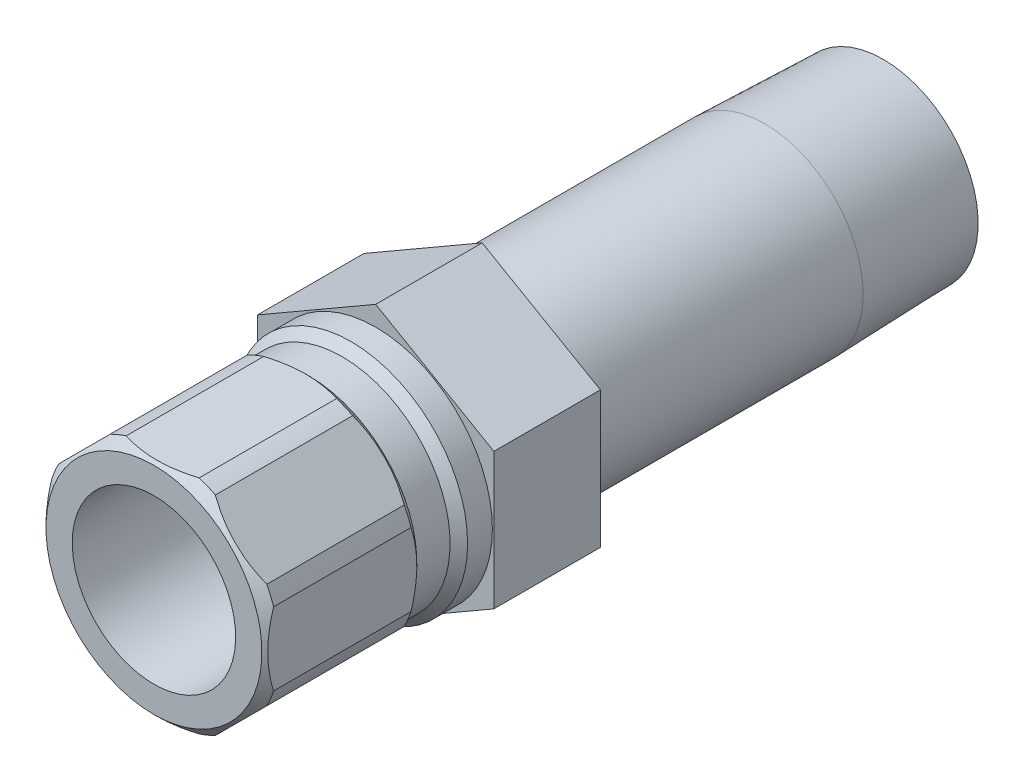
SolidWorks part; units mm, degrees
ref_plane "Front Plane" through (0, 0, 0) normal (0, 0, 1) x (1, 0, 0)
ref_plane "Top Plane" through (0, 0, 0) normal (0, 1, 0) x (1, 0, 0)
ref_plane "Right Plane" through (0, 0, 0) normal (1, 0, 0) x (0, 0, -1)
sketch "Sketch1" plane through (0, 0, 0) normal (1, 0, 0) x (0, 0, -1)
  line L0 (0, 0) -> (-22.479, 0) construction
  line L1 (-19.304, 7.112) -> (-19.304, 9.398)
  line L2 (-5.8166, 9.398) -> (-5.8166, 0) construction
  line L3 (-18.542, 10.16) -> (-6.5786, 10.16)
  line L4 (0, 8.5725) -> (0, 0) construction
  line L5 (-5.8166, 9.398) -> (-2.921, 9.398)
  line L6 (-2.159, 10.16) -> (0, 10.16)
  line L7 (0, 10.16) -> (0, 8.5725)
  line L8 (-5.8166, 9.398) -> (-6.5786, 10.16)
  line L9 (-2.921, 9.398) -> (-2.159, 10.16)
  line L10 (-19.304, 9.398) -> (-18.542, 10.16)
  line L11 (-19.304, 7.112) -> (-1.524, 7.112)
  line L12 (0, 8.5725) -> (33.8582, 8.5725)
  line L13 (33.8582, 8.5725) -> (44.196, 8.2494)
  line L14 (44.196, 8.2494) -> (44.196, 6.2611)
  line L15 (0, 10.16) -> (9.271, 10.16) construction
  line L16 (9.271, 10.16) -> (9.271, 7.112) construction
  line L17 (9.271, 0) -> (0, 0) construction
  line L18 (-1.524, 7.112) -> (-0.6731, 6.2611)
  line L19 (-0.6731, 6.2611) -> (44.196, 6.2611)
  dimension "D1" = 19.304
  dimension "D2" = 2.8956
  dimension "D3" = 0.762
  dimension "D4" = 45
  dimension "D5" = 13.4874
  dimension "D6" = 45
  dimension "D7" = 1.79
  dimension "D8" = 10.3378
  dimension "D9" = 63.5
  dimension "D10" = 3.175
  dimension "D11" = 28.575
  dimension "D12" = 14.224
  dimension "D13" = 17.145
  dimension "D14" = 20.32
  dimension "D15" = 12.5222
  dimension "D16" = 17.78
revolve "Revolve1" add sketch "Sketch1" angle 360 about L0
sketch "Sketch2" plane through (0, 0, 0) normal (0, 0, 1) x (1, 0, 0)
  line L1 (-10.287, 5.9392) -> (-10.287, -5.9392)
  line L2 (-10.287, -5.9392) -> (0, -11.8784)
  line L3 (0, -11.8784) -> (10.287, -5.9392)
  line L4 (10.287, -5.9392) -> (10.287, 5.9392)
  line L5 (10.287, 5.9392) -> (0, 11.8784)
  line L6 (0, 11.8784) -> (-10.287, 5.9392)
  circle A0 centre (0, 0) radius 10.287 construction
  circle A1 centre (0, 0) radius 6.2611 construction
  circle A2 centre (0, 0) radius 6.2611
  dimension "D1" = 20.574
extrude "Boss-Extrude1" add sketch "Sketch2" against normal up to vertex (9.271 mm away) from vertex at 0
sketch "Sketch3" plane through (0, 0, 0) normal (0, 0, 1) x (1, 0, 0)
  line L1 (9.652, -3.998) -> (9.652, 3.998)
  line L2 (9.652, 3.998) -> (3.998, 9.652)
  line L3 (3.998, 9.652) -> (-3.998, 9.652)
  line L4 (-3.998, 9.652) -> (-9.652, 3.998)
  line L5 (-9.652, 3.998) -> (-9.652, -3.998)
  line L6 (-9.652, -3.998) -> (-3.998, -9.652)
  line L7 (-3.998, -9.652) -> (3.998, -9.652)
  line L8 (3.998, -9.652) -> (9.652, -3.998)
  circle A0 centre (0, 0) radius 9.652 construction
  dimension "D1" = 19.304
extrude "Cut-Extrude1" cut sketch "Sketch3" along normal through all from vertex at 5.8166 flip side to cut
